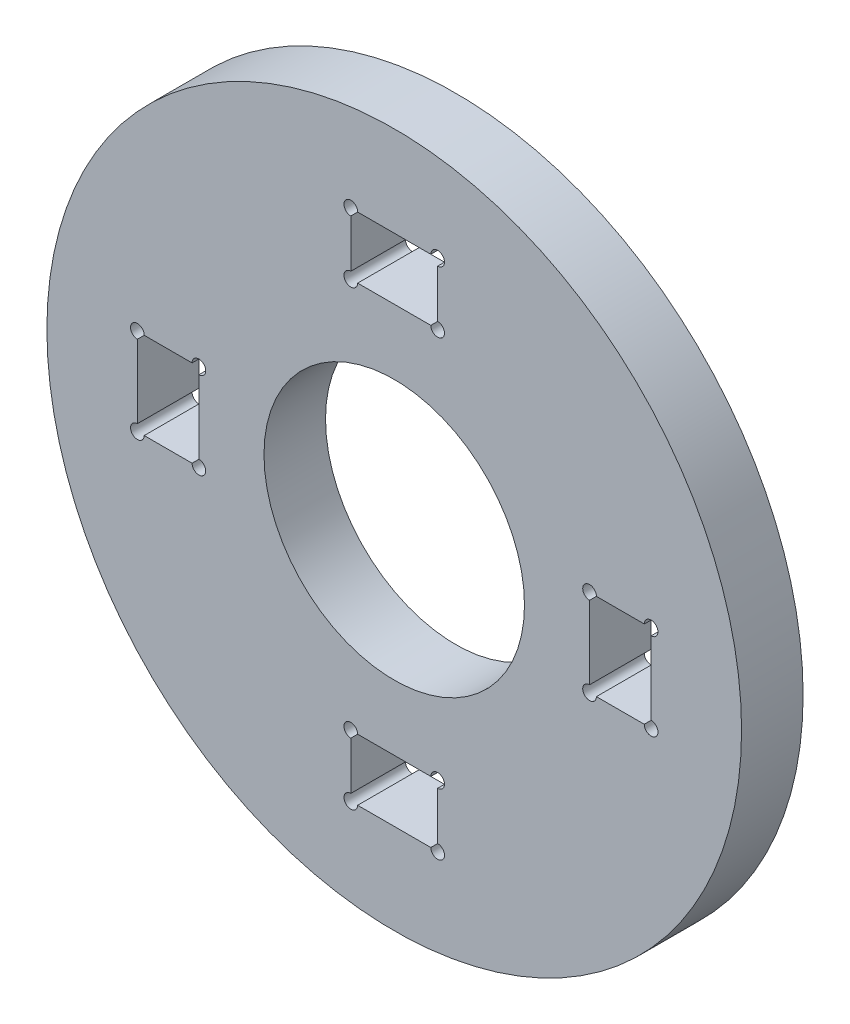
SolidWorks part; units mm, degrees
ref_plane "Front Plane" through (0, 0, 0) normal (0, 0, 1) x (1, 0, 0)
ref_plane "Top Plane" through (0, 0, 0) normal (0, 1, 0) x (1, 0, 0)
ref_plane "Right Plane" through (0, 0, 0) normal (1, 0, 0) x (0, 0, -1)
sketch "Sketch1" plane through (0, 0, 0) normal (0, 0, 1) x (1, 0, 0)
  circle A0 centre (0, 0) radius 2.5
  circle A1 centre (0, 0) radius 25.4
  dimension "D1" = 5
  dimension "D2" = 50.8
extrude "Boss-Extrude1" add sketch "Sketch1" along normal blind 4.5
sketch "Sketch2" plane through (0, 0, 4.5) normal (0, 0, 1) x (1, 0, 0)
  line L0 (0, 18.7836) -> (0, 14.2836) construction
  line L1 (-3.175, 18.7836) -> (3.175, 18.7836)
  line L2 (-3.175, 18.7836) -> (-3.175, 14.2836)
  line L3 (-3.175, 14.2836) -> (3.175, 14.2836)
  line L4 (3.175, 18.7836) -> (3.175, 14.2836)
  line L5 (14.2836, 3.175) -> (14.2836, -3.175)
  line L6 (18.7836, 3.175) -> (14.2836, 3.175)
  line L7 (18.7836, 3.175) -> (18.7836, -3.175)
  line L8 (18.7836, -3.175) -> (14.2836, -3.175)
  line L9 (3.175, -14.2836) -> (-3.175, -14.2836)
  line L10 (3.175, -18.7836) -> (3.175, -14.2836)
  line L11 (3.175, -18.7836) -> (-3.175, -18.7836)
  line L12 (-3.175, -18.7836) -> (-3.175, -14.2836)
  line L13 (-14.2836, -3.175) -> (-14.2836, 3.175)
  line L14 (-18.7836, -3.175) -> (-14.2836, -3.175)
  line L15 (-18.7836, -3.175) -> (-18.7836, 3.175)
  line L16 (-18.7836, 3.175) -> (-14.2836, 3.175)
  circle A0 centre (0, 0) radius 19.05
  circle A1 centre (0, 0) radius 17.4625
  arc A2 (-2.675, 18.7836) -> (-3.175, 18.2836) centre (-3.175, 18.7836) ccw
  arc A3 (-3.175, 14.7836) -> (-2.675, 14.2836) centre (-3.175, 14.2836) ccw
  arc A4 (3.175, 14.7836) -> (2.675, 14.2836) centre (3.175, 14.2836) cw
  arc A5 (2.675, 18.7836) -> (3.175, 18.2836) centre (3.175, 18.7836) cw
  arc A6 (18.7836, 2.675) -> (18.2836, 3.175) centre (18.7836, 3.175) ccw
  arc A7 (18.7836, -2.675) -> (18.2836, -3.175) centre (18.7836, -3.175) cw
  arc A8 (14.7836, -3.175) -> (14.2836, -2.675) centre (14.2836, -3.175) cw
  arc A9 (14.7836, 3.175) -> (14.2836, 2.675) centre (14.2836, 3.175) ccw
  arc A10 (2.675, -18.7836) -> (3.175, -18.2836) centre (3.175, -18.7836) ccw
  arc A11 (-2.675, -18.7836) -> (-3.175, -18.2836) centre (-3.175, -18.7836) cw
  arc A12 (-3.175, -14.7836) -> (-2.675, -14.2836) centre (-3.175, -14.2836) cw
  arc A13 (3.175, -14.7836) -> (2.675, -14.2836) centre (3.175, -14.2836) ccw
  arc A14 (-18.7836, -2.675) -> (-18.2836, -3.175) centre (-18.7836, -3.175) ccw
  arc A15 (-18.7836, 2.675) -> (-18.2836, 3.175) centre (-18.7836, 3.175) cw
  arc A16 (-14.7836, 3.175) -> (-14.2836, 2.675) centre (-14.2836, 3.175) cw
  arc A17 (-14.7836, -3.175) -> (-14.2836, -2.675) centre (-14.2836, -3.175) ccw
  point P26 (0, 0)
  dimension "D1" = 38.1
  dimension "D7" = 0.5
  dimension "D8" = 0.5
  dimension "D9" = 0.5
  dimension "D10" = 0.5
  dimension "D3" = 4.5
  dimension "D4" = 6.35
  dimension "D5" = 0
  dimension "D2" = 1.5875
  dimension "D6" = 4
extrude "Cut-Extrude1" cut sketch "Sketch2" against normal through all contours L16 A1 L14 L13 | A1 L16 L15 L14 | L1 L0 A1 L4 | L0 L1 L2 A1 | L0 A1 L2 L3 | A1 L0 L3 L4 | L8 A1 L6 L5 | A1 L8 L7 L6 | L12 A1 L10 L9 | A1 L12 L11 L10 | A0 A2 L2 | L1 A2 A0 | A0 A2 | A5 L1 A0 | A5 A0 | A5 A0 L4 | A4 L4 L3 | L2 A3 L3 | A8 L8 L5 | L6 A9 L5 | A0 A6 L6 | A0 A6 | L7 A6 A0 | A7 A0 L8 | A7 A0 | A7 L7 A0 | A11 A0 | A12 L12 L9 | L10 A13 L9 | A0 A10 | A0 A10 L10 | L11 A10 A0 | A11 A0 L12 | A11 L11 A0 | A15 A0 | A15 A0 L16 | A15 L15 A0 | A16 L16 L13 | L14 A17 L13 | A0 A14 L14 | A0 A14 | L15 A14 A0
sketch "Sketch3" plane through (0, 0, 4.5) normal (0, 0, 1) x (1, 0, 0)
  circle A0 centre (0, 0) radius 9.525
  point P8 (0, 0)
  dimension "D1" = 19.05
extrude "Cut-Extrude2" cut sketch "Sketch3" against normal through all
